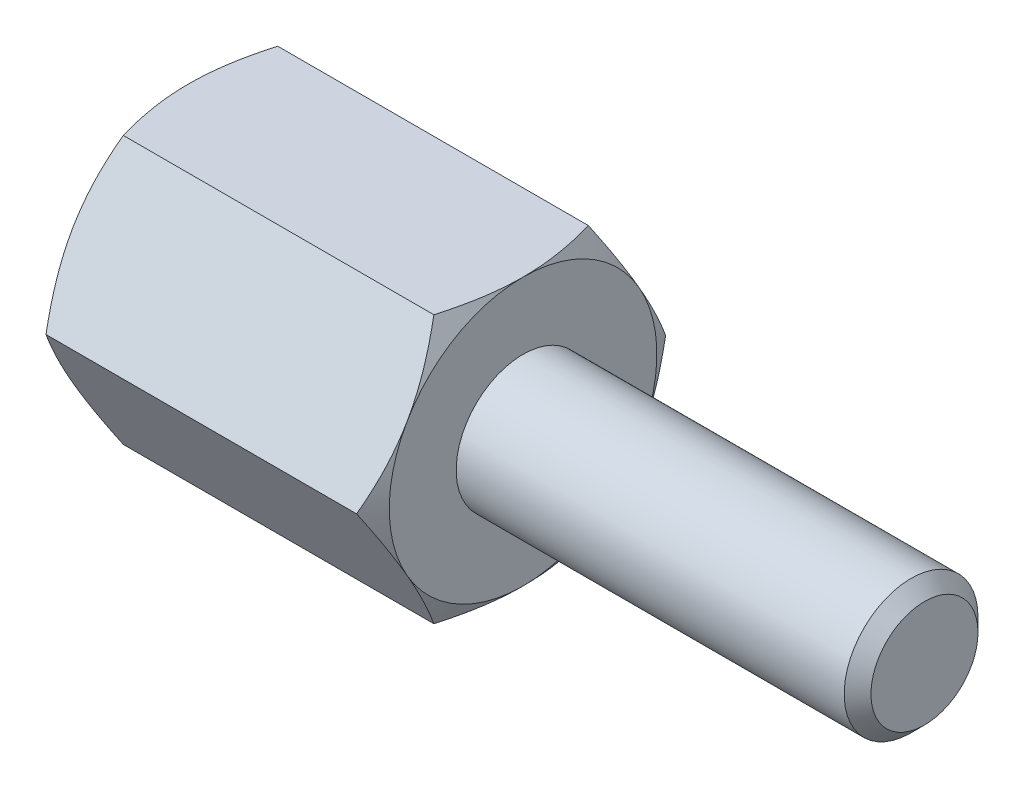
SolidWorks part; units mm, degrees
ref_plane "Front Plane" through (0, 0, 0) normal (0, 0, 1) x (1, 0, 0)
ref_plane "Top Plane" through (0, 0, 0) normal (0, 1, 0) x (1, 0, 0)
ref_plane "Right Plane" through (0, 0, 0) normal (1, 0, 0) x (0, 0, -1)
sketch "Sketch1" plane through (0, 0, 0) normal (1, 0, 0) x (0, 0, -1)
  line L1 (1.1547, 2) -> (-1.1547, 2)
  line L2 (-1.1547, 2) -> (-2.3094, 0)
  line L3 (-2.3094, 0) -> (-1.1547, -2)
  line L4 (-1.1547, -2) -> (1.1547, -2)
  line L5 (1.1547, -2) -> (2.3094, 0)
  line L6 (2.3094, 0) -> (1.1547, 2)
  circle A0 centre (0, 0) radius 2 construction
  dimension "D1" = 4
extrude "Extrude2" add sketch "Sketch1" along normal mid plane 5
sketch "Sketch2" plane through (0, 0, 0) normal (0, 0, 1) x (1, 0, 0)
  line L0 (-2.5, 2) -> (-1, 4.5981)
  line L1 (-2.5, 5) -> (-2.5, 2)
  line L3 (0, 0) -> (50000, 0) construction
  arc A0 (-1, 4.5981) -> (-2.5, 5) centre (-1.6962, 5) ccw
  dimension "D1" = 30
  dimension "D2" = 3
revolve "Cut-Revolve1" cut sketch "Sketch2" angle 360 about L3
mirror "Mirror1" about plane through (0, 0, 0) normal (1, 0, 0) of "Cut-Revolve1"
sketch "Sketch3" plane through (-2.5, 0, 0) normal (-1, 0, 0) x (0, 0, 1)
  circle A0 centre (0, 0) radius 0.8
  dimension "D1" = 1.6
extrude "Extrude3" cut sketch "Sketch3" against normal blind 2.5
sketch "Sketch4" plane through (0, 0, 0) normal (0, 0, 1) x (1, 0, 0)
  line L0 (0, 0) -> (0, 0.8)
  line L1 (2.3214, 0) -> (-2.3214, 0) construction
  line L2 (0, 0.8) -> (0.4619, 0)
  line L3 (0.4619, 0) -> (0, 0)
  line L4 (-2.5, 1) -> (-2.5, -1) construction
  point P4 (-2.5, 0)
  dimension "D1" = 30
  dimension "D2" = 0.8
  dimension "D3" = 2.5
revolve "Cut-Revolve2" cut sketch "Sketch4" angle 360 about L3
sketch "Sketch5" plane through (2.5, 0, 0) normal (1, 0, 0) x (0, 0, -1)
  circle A0 centre (0, 0) radius 1
  dimension "D1" = 2
extrude "Extrude4" add sketch "Sketch5" along normal blind 6
chamfer "Chamfer1" distance 0.2 angle 45 1 edges at (8.5, 0, -1)
equation "\"D2@Sketch4\" = \"D1@Sketch3\"/2"
